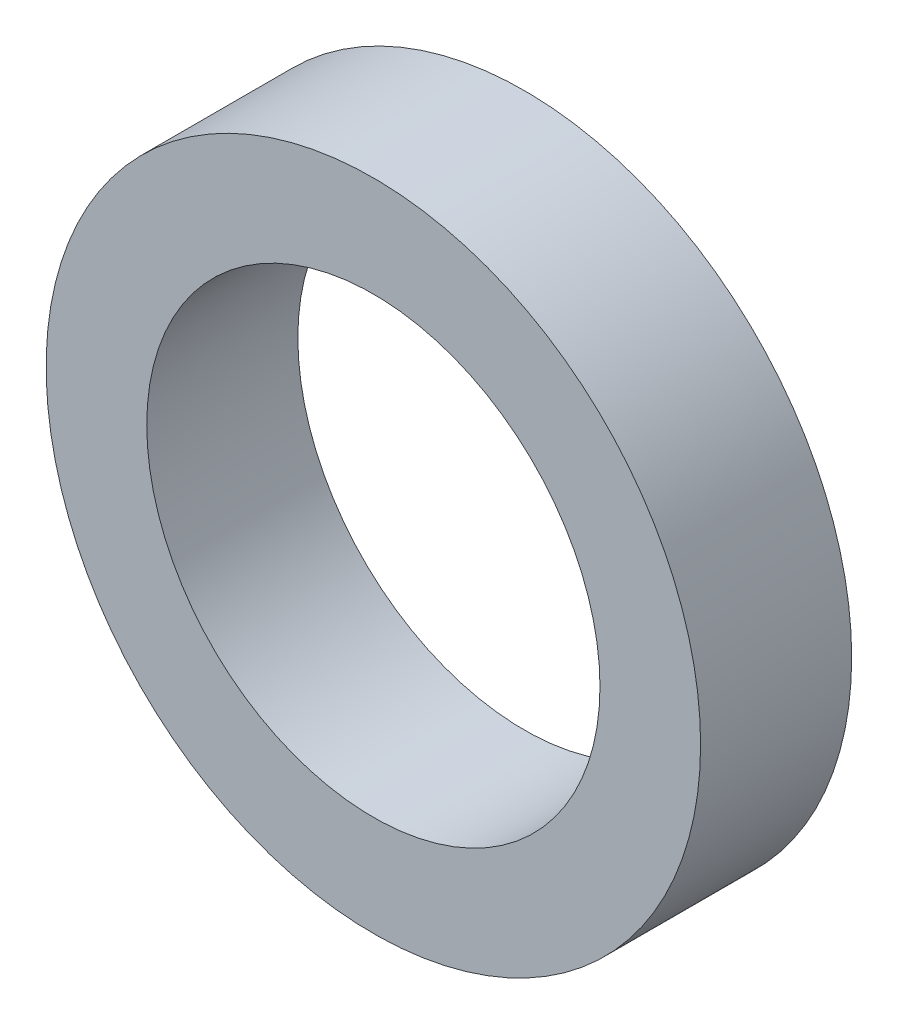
SolidWorks part; units mm, degrees
ref_plane "Front Plane" through (0, 0, 0) normal (0, 0, 1) x (1, 0, 0)
ref_plane "Top Plane" through (0, 0, 0) normal (0, 1, 0) x (1, 0, 0)
ref_plane "Right Plane" through (0, 0, 0) normal (1, 0, 0) x (0, 0, -1)
sketch "Sketch1" plane through (0, 0, 0) normal (0, 0, 1) x (1, 0, 0)
  circle A0 centre (0, 0) radius 82.5246
extrude "Boss-Extrude1" add sketch "Sketch1" along normal blind 38.1
sketch "Sketch2" plane through (0, 0, 0) normal (0, 0, 1) x (1, 0, 0)
  circle A0 centre (0, 0) radius 57.15
extrude "Cut-Extrude1" cut sketch "Sketch2" along normal through all
